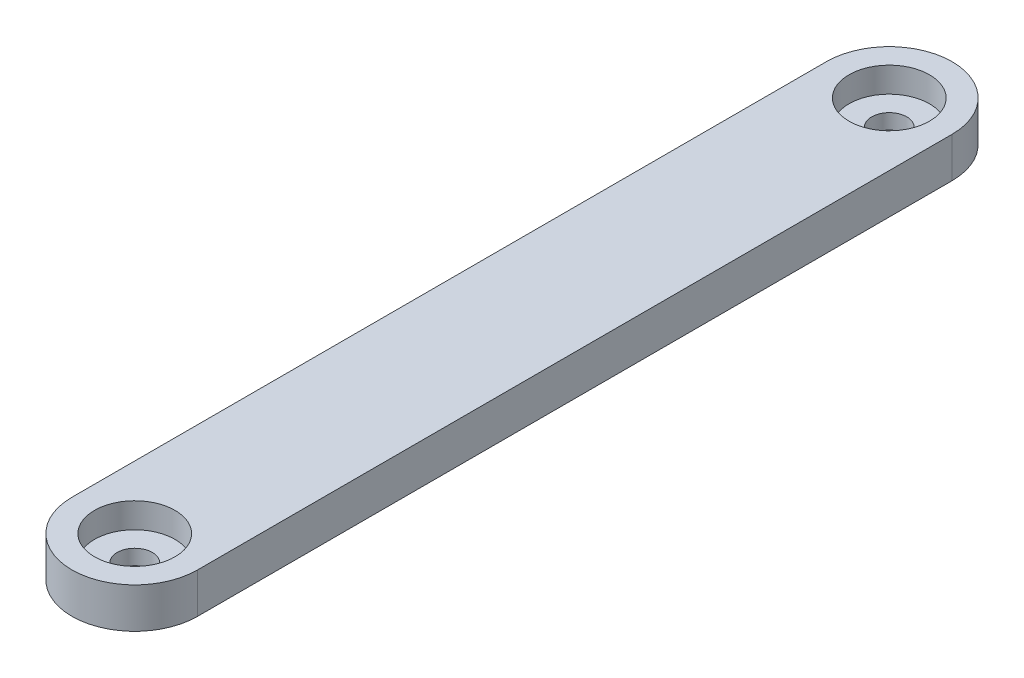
SolidWorks part; units mm, degrees
ref_plane "Front Plane" through (0, 0, 0) normal (0, 0, 1) x (1, 0, 0)
ref_plane "Top Plane" through (0, 0, 0) normal (0, 1, 0) x (1, 0, 0)
ref_plane "Right Plane" through (0, 0, 0) normal (1, 0, 0) x (0, 0, -1)
sketch "Sketch1" plane through (0, 0, 0) normal (0, 1, 0) x (1, 0, 0)
  line L0 (0, 0) -> (-34216.6977, 0) construction
  line L1 (0, 0) -> (0, -34216.6977) construction
  line L2 (-12.5, 0) -> (-12.5, -150)
  line L3 (12.5, 0) -> (12.5, -150)
  arc A0 (12.5, 0) -> (-12.5, 0) centre (0, 0) ccw
  arc A1 (-12.5, -150) -> (12.5, -150) centre (0, -150) ccw
  dimension "D1" = 25
  dimension "D2" = 25
  dimension "D3" = 150
extrude "Boss-Extrude1" add sketch "Sketch1" along normal blind 8
sketch "Sketch2" plane through (0, 8, 0) normal (0, 1, 0) x (1, 0, 0)
  line L0 (0, 0) -> (-50000, 0) construction
  line L1 (0, 0) -> (0, -50000) construction
  circle A0 centre (0, 0) radius 8
  dimension "D1" = 16
extrude "Cut-Extrude1" cut sketch "Sketch2" against normal blind 5
sketch "Sketch3" plane through (0, 8, 0) normal (0, 1, 0) x (1, 0, 0)
  line L0 (0, 0) -> (-50000, 0) construction
  line L1 (0, 0) -> (0, -50000) construction
  circle A0 centre (0, 0) radius 3.5
  dimension "D1" = 7
extrude "Cut-Extrude2" cut sketch "Sketch3" against normal through all
sketch "Sketch4" plane through (0, 8, 0) normal (0, 1, 0) x (1, 0, 0)
  line L0 (0, -150) -> (-50000, -150) construction
  line L1 (0, -150) -> (0, -50150) construction
  line L2 (0, 0) -> (-42404.7642, 0) construction
  circle A1 centre (0, -150) radius 8
  dimension "D1" = 16
extrude "Cut-Extrude3" cut sketch "Sketch4" against normal blind 5
sketch "Sketch5" plane through (0, 8, 0) normal (0, 1, 0) x (1, 0, 0)
  circle A0 centre (0, -150) radius 3.5
  dimension "D1" = 7
extrude "Cut-Extrude4" cut sketch "Sketch5" against normal through all
